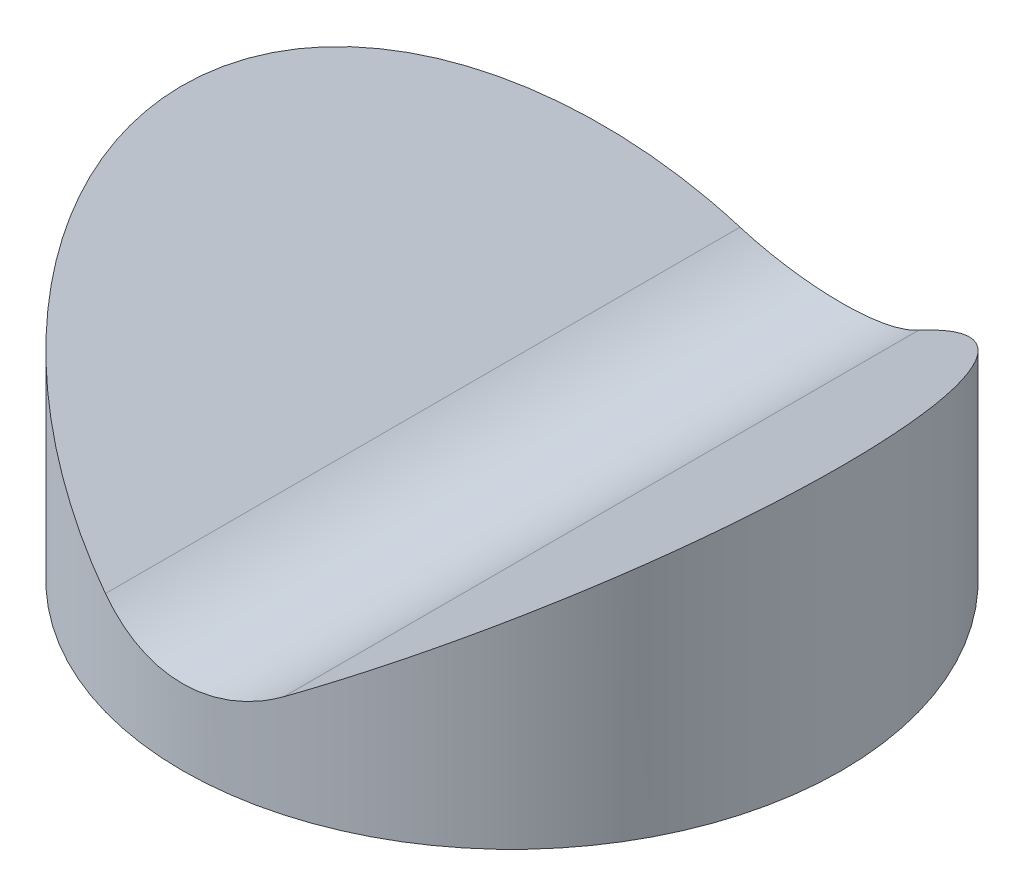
SolidWorks part; units mm, degrees
ref_plane "Front Plane" through (0, 0, 0) normal (0, 0, 1) x (1, 0, 0)
ref_plane "Top Plane" through (0, 0, 0) normal (0, 1, 0) x (1, 0, 0)
ref_plane "Right Plane" through (0, 0, 0) normal (1, 0, 0) x (0, 0, -1)
sketch "Sketch1" plane through (0, 0, 0) normal (0, 1, 0) x (1, 0, 0)
  circle A0 centre (0, 0) radius 3.5
  dimension "D1" = 7
extrude "Boss-Extrude1" add sketch "Sketch1" along normal blind 0.8
ref_point "Point1"
sketch "Sketch2" plane through (0, 0.8, 0) normal (0, 1, 0) x (1, 0, 0)
  line L0 (0, 0) -> (0, 3.5) construction
  circle A0 centre (0, 0) radius 3.5 construction
sketch "Sketch3" plane through (0, 0, 0) normal (0, 0, 1) x (1, 0, 0)
  line L0 (-3.5, 0.8) -> (-3.5, 2.8)
  line L1 (-3.5, 2.8) -> (-0.9479, 1.0884)
  line L2 (3.5, 0.8) -> (3.5, 2.8)
  line L3 (3.5, 2.8) -> (0.9479, 1.0884)
  line L5 (-3.5, 0.8) -> (-3.5, 0)
  line L6 (-3.5, 0) -> (3.5, 0)
  line L7 (3.5, 0) -> (3.5, 0.8)
  line L9 (3.5, 0.8) -> (-3.5, 0.8) construction
  arc A0 (-0.9479, 1.0884) -> (0.9479, 1.0884) centre (0, 2.5018) ccw
  dimension "D2" = 1.7018
  dimension "D1" = 2
extrude "Boss-Extrude2" add sketch "Sketch3" along normal up to surface and the other way up to surface
